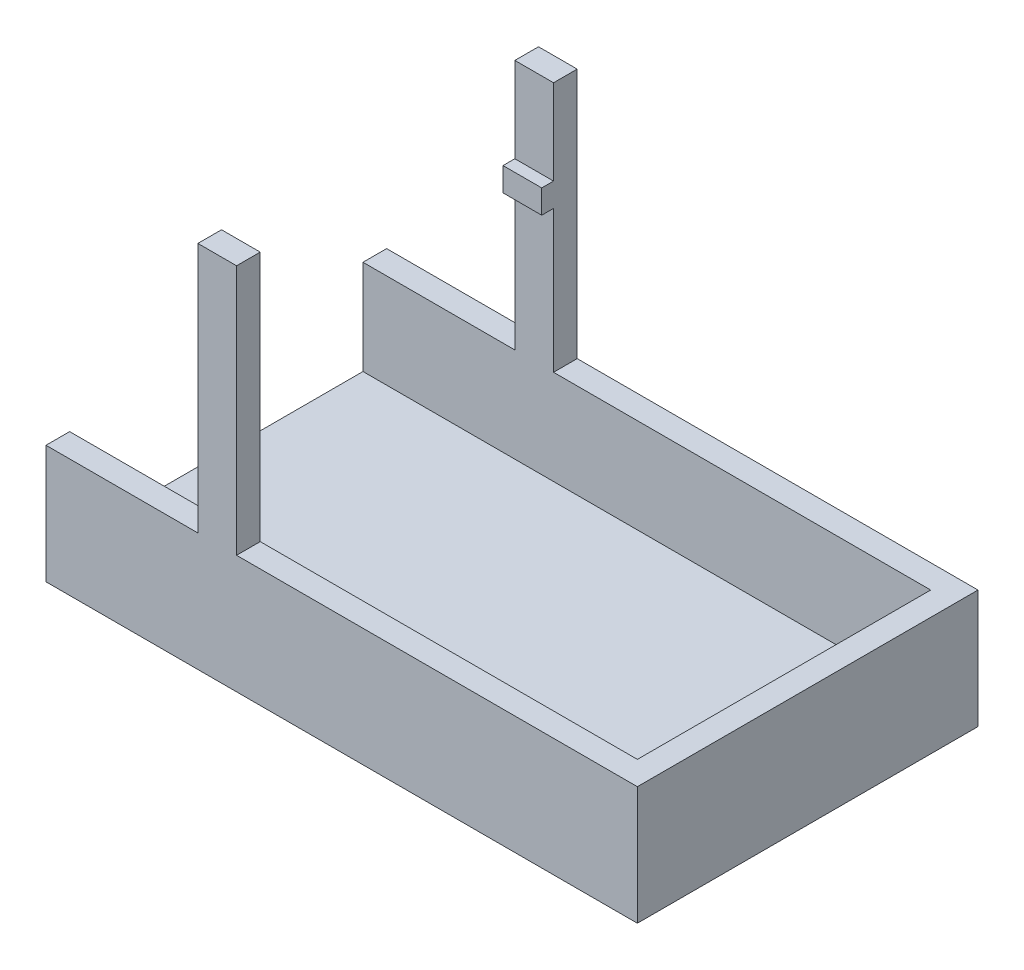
SolidWorks part; units mm, degrees
ref_plane "Front" through (0, 0, 0) normal (0, 0, 1) x (1, 0, 0)
ref_plane "Top" through (0, 0, 0) normal (0, 1, 0) x (1, 0, 0)
ref_plane "Right" through (0, 0, 0) normal (1, 0, 0) x (0, 0, -1)
sketch "Sketch1" plane through (0, 0, 0) normal (0, 0, 1) x (1, 0, 0)
  line L0 (0, 0) -> (250, 0)
  line L1 (250, 0) -> (250, 50)
  line L2 (250, 50) -> (0, 50)
  line L3 (0, 50) -> (0, 0)
  dimension "D1" = 50
  dimension "D2" = 250
extrude "Extrude1" add sketch "Sketch1" along normal mid plane 144
shell "Shell1" thickness 10
sketch "Sketch2" plane through (0, 50, 0) normal (0, 1, 0) x (-1, 0, 0)
  line L1 (-250, 72) -> (0, 72) construction
  line L2 (-80.563, 72) -> (-64.2012, 72)
  line L3 (-80.563, 72) -> (-80.563, 62)
  line L4 (-80.563, 62) -> (-64.2012, 62)
  line L5 (-64.2012, 72) -> (-64.2012, 62)
  line L6 (-240, 62) -> (0, 62) construction
  line L7 (-250, -72) -> (0, -72) construction
  line L8 (-80.563, -72) -> (-64.2012, -72)
  line L9 (-80.563, -72) -> (-80.563, -62)
  line L10 (-80.563, -62) -> (-64.2012, -62)
  line L11 (-64.2012, -72) -> (-64.2012, -62)
  line L12 (-240, -62) -> (0, -62) construction
extrude "Extrude2" add sketch "Sketch2" along normal blind 106
sketch "Sketch5" plane through (0, 0, -62) normal (0, 0, 1) x (1, 0, 0)
  line L0 (64.2012, 156) -> (64.2012, 50) construction
  line L1 (64.2012, 120) -> (80.563, 120)
  line L2 (64.2012, 120) -> (64.2012, 110)
  line L3 (64.2012, 110) -> (80.563, 110)
  line L4 (80.563, 120) -> (80.563, 110)
  line L5 (80.563, 156) -> (80.563, 50) construction
  line L6 (0, 10) -> (240, 10) construction
  dimension "D1" = 100
  dimension "D2" = 10
extrude "Extrude3" add sketch "Sketch5" along normal blind 5
